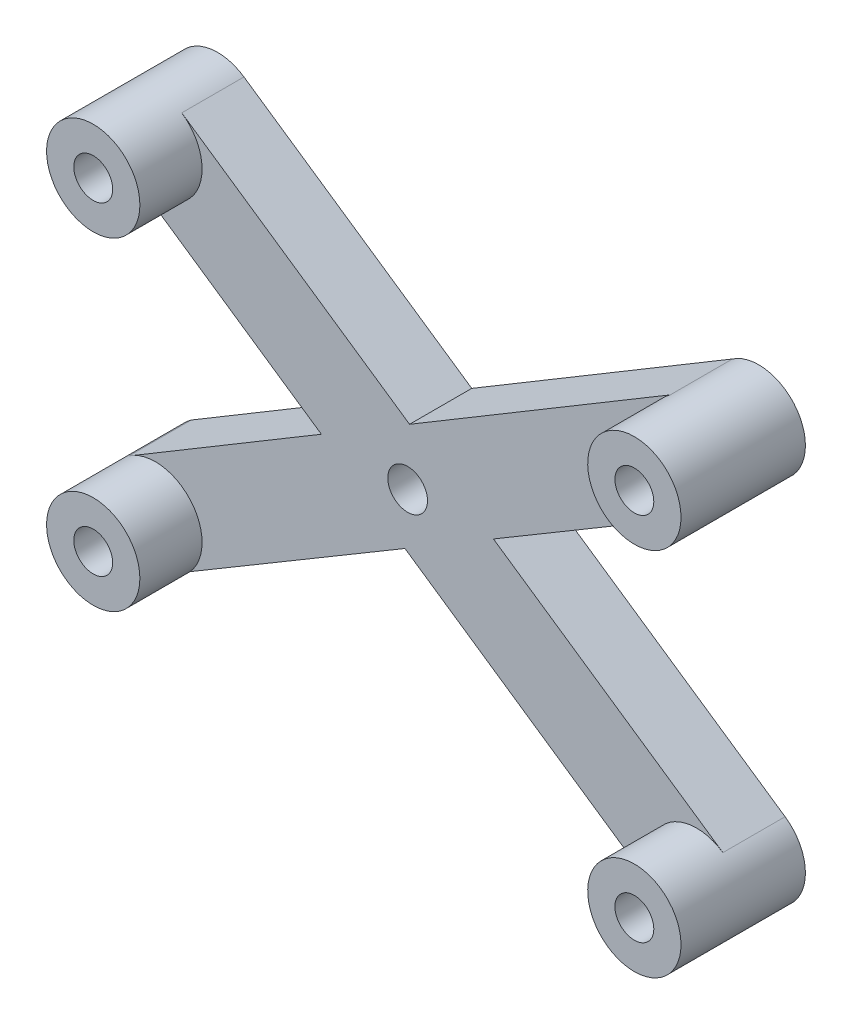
SolidWorks part; units mm, degrees
ref_plane "Plan de face" through (0, 0, 0) normal (0, 0, 1) x (1, 0, 0)
ref_plane "Plan de dessus" through (0, 0, 0) normal (0, 1, 0) x (1, 0, 0)
ref_plane "Plan de droite" through (0, 0, 0) normal (1, 0, 0) x (0, 0, -1)
sketch "Esquisse1" plane through (0, 0, 0) normal (0, 0, 1) x (1, 0, 0)
  line L0 (-0.8643, 38.5815) -> (33.9357, 14.7815)
  line L1 (2.5228, 43.534) -> (37.3228, 19.734)
  line L2 (-0.8643, 22.734) -> (33.9357, 43.534)
  line L3 (37.3228, 38.5815) -> (3.0563, 18.2477)
  circle A0 centre (0.8293, 41.0578) radius 1.8964
  circle A1 centre (35.6293, 41.0578) radius 1.8964
  circle A2 centre (35.6293, 17.2578) radius 1.65
  circle A3 centre (0.8293, 20.2578) radius 1.65
  circle A4 centre (0.8293, 41.0578) radius 3
  circle A5 centre (35.6293, 41.0578) radius 3
  circle A6 centre (0.8293, 20.2578) radius 3
  circle A7 centre (35.6293, 17.2578) radius 3
  circle A8 centre (17.0489, 29.8284) radius 1.2779
  dimension "D1" = 34.8
  dimension "D2" = 23.8
  dimension "D3" = 3.3
  dimension "D4" = 20.8
  dimension "D5" = 3.3
  dimension "D6" = 6
  dimension "D7" = 6
extrude "Boss.-Extru.2" add sketch "Esquisse1" along normal blind 4 contours A4 L0 L2 L1 | A0 | A4 A0 | A6 L3 L0 L2 | A3 | L2 A6 A3 | A7 L1 L3 L0 | A2 | A7 A2 | L3 L1 L2 L0 A8 | A5 L2 L1 L3 | A5 L3 A1 | A1
sketch "Esquisse2" plane through (0, 0, 4) normal (0, 0, 1) x (1, 0, 0)
  circle A0 centre (0.8293, 41.0578) radius 1.25
  circle A1 centre (35.6293, 17.2578) radius 1.25
  circle A2 centre (0.8293, 20.2578) radius 1.25
  circle A3 centre (35.6293, 41.0578) radius 1.25
  circle A5 centre (0.8293, 41.0578) radius 3
  circle A6 centre (0.8293, 20.2578) radius 3
  circle A7 centre (35.6293, 17.2578) radius 3
  circle A8 centre (35.6293, 41.0578) radius 3
  dimension "D1" = 2.5
  dimension "D2" = 2.5
  dimension "D3" = 2.5
  dimension "D4" = 2.5
extrude "Boss.-Extru.3" add sketch "Esquisse2" along normal blind 4
